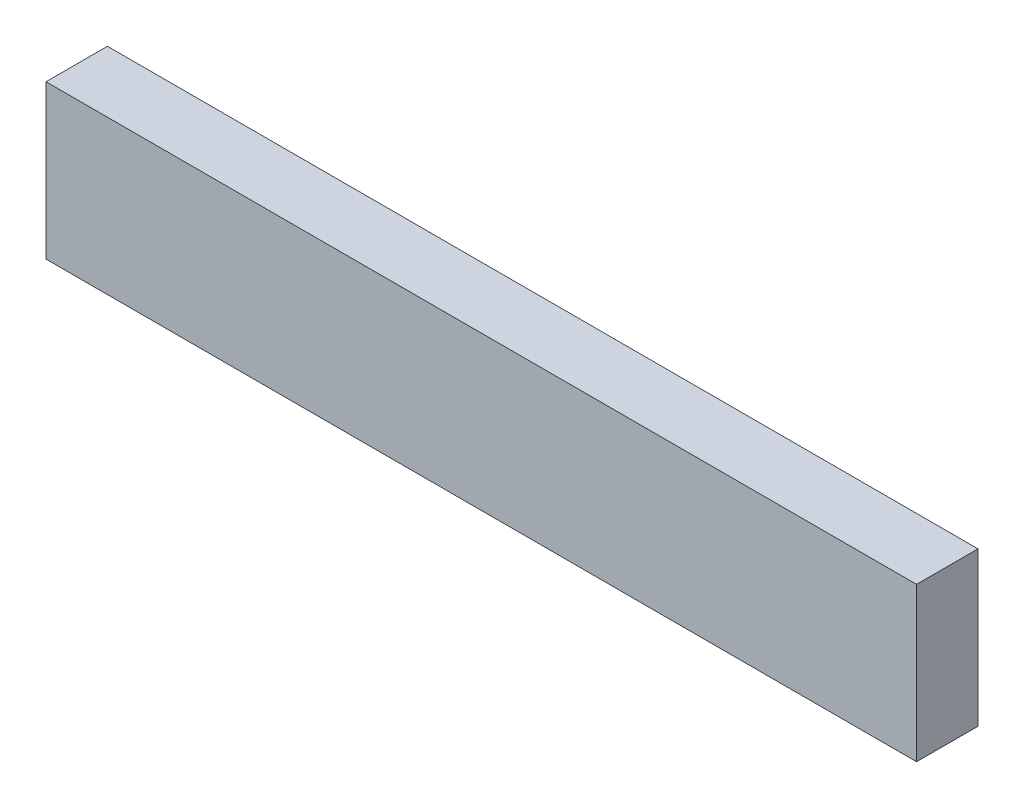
SolidWorks part; units mm, degrees
ref_plane "Front Plane" through (0, 0, 0) normal (0, 0, 1) x (1, 0, 0)
ref_plane "Top Plane" through (0, 0, 0) normal (0, 1, 0) x (1, 0, 0)
ref_plane "Right Plane" through (0, 0, 0) normal (1, 0, 0) x (0, 0, -1)
sketch "Sketch1" plane through (0, 0, 0) normal (0, 0, 1) x (1, 0, 0)
  line L1 (-170, 30) -> (0, 30)
  line L2 (-170, 30) -> (-170, 0)
  line L3 (-170, 0) -> (0, 0)
  line L4 (0, 30) -> (0, 0)
  dimension "D1" = 170
  dimension "D2" = 30
extrude "Boss-Extrude1" add sketch "Sketch1" along normal blind 12
